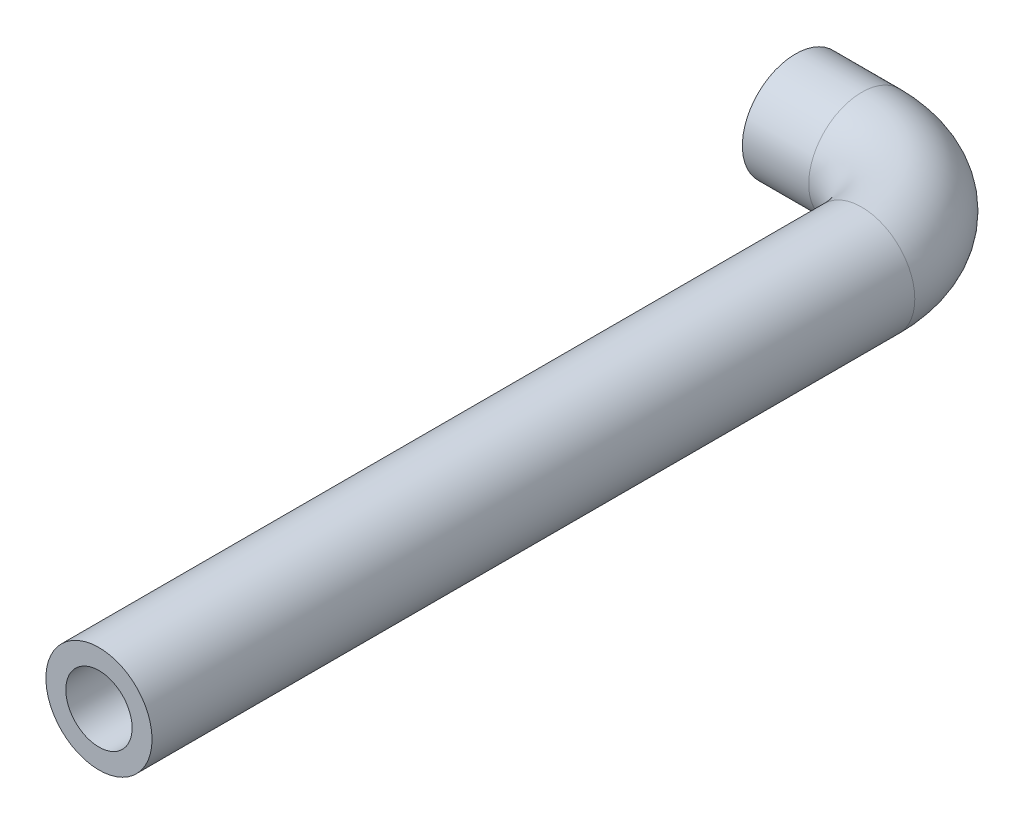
SolidWorks part; units mm, degrees
ref_plane "Front Plane" through (0, 0, 0) normal (0, 0, 1) x (1, 0, 0)
ref_plane "Top Plane" through (0, 0, 0) normal (0, 1, 0) x (1, 0, 0)
ref_plane "Right Plane" through (0, 0, 0) normal (1, 0, 0) x (0, 0, -1)
sketch "Sketch_Tube Path" plane through (0, 0, 0) normal (0, 1, 0) x (1, 0, 0)
  line L0 (0, 0) -> (10, 0)
  line L1 (25, -15) -> (25, -130)
  arc A0 (10, 0) -> (25, -15) centre (10, -15) cw
  dimension "D3" = 15
  dimension "D1" = 10
  dimension "D2" = 115
sketch "Sketch_Tube Section" plane through (0, 0, 0) normal (1, 0, 0) x (0, 0, -1)
  circle A0 centre (0, 0) radius 8
  circle A1 centre (0, 0) radius 5
  dimension "D1" = 16
  dimension "D2" = 10
sweep "Sweep_Toothpaste Tube" add profiles "Sketch_Tube Section" path "Sketch_Tube Path"
ref_plane "Plane_Tank Plane" through (25, 0, 0) normal (1, 0, 0) x (0, 0, -1)
